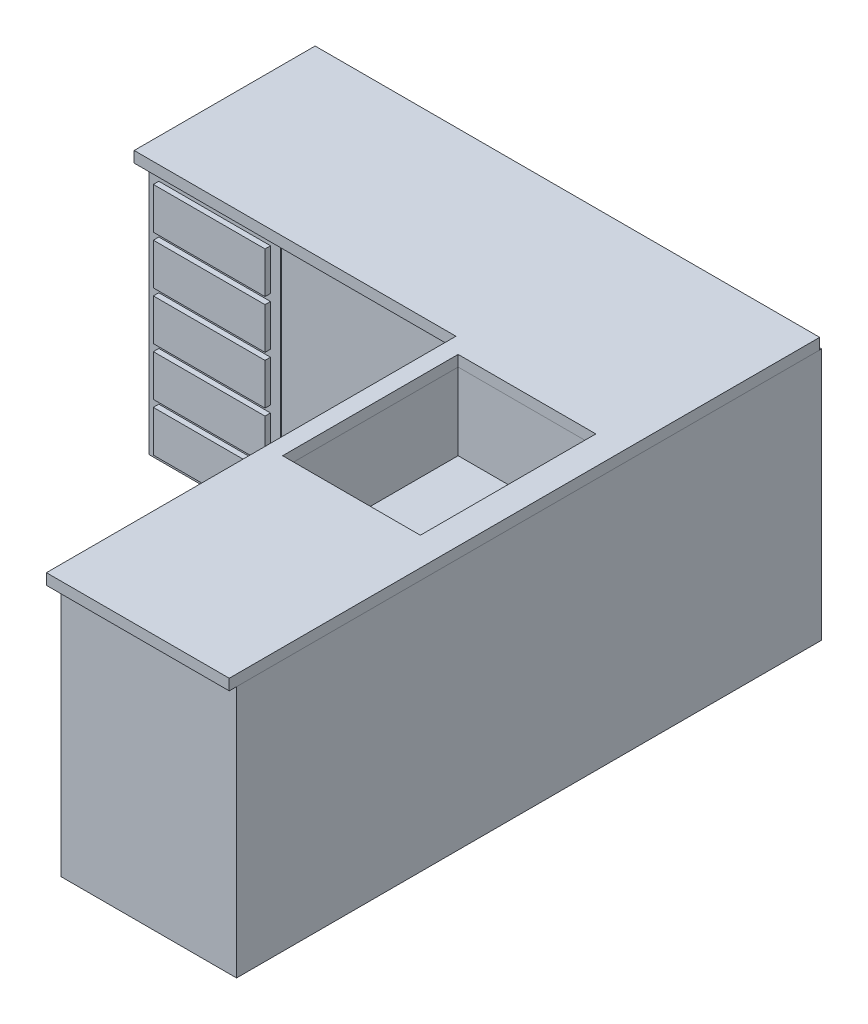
SolidWorks part; units mm, degrees
ref_plane "Front Plane" through (0, 0, 0) normal (0, 0, 1) x (1, 0, 0)
ref_plane "Top Plane" through (0, 0, 0) normal (0, 1, 0) x (1, 0, 0)
ref_plane "Right Plane" through (0, 0, 0) normal (1, 0, 0) x (0, 0, -1)
sketch "Sketch1" plane through (0, 0, 0) normal (0, 0, 1) x (1, 0, 0)
  line L1 (0, 0) -> (1727.2, 0)
  line L2 (0, 0) -> (0, 876.3)
  line L3 (0, 876.3) -> (1727.2, 876.3)
  line L4 (1727.2, 0) -> (1727.2, 876.3)
  dimension "D1" = 876.3
  dimension "D2" = 1727.2
extrude "Boss-Extrude1" add sketch "Sketch1" against normal blind 609.6
sketch "Sketch2" plane through (0, 876.3, 0) normal (0, 1, 0) x (1, 0, 0)
  line L0 (1727.2, 609.6) -> (1727.2, 0) construction
  line L1 (-25.4, 603.0881) -> (1727.2, 603.0881)
  line L2 (-25.4, 603.0881) -> (-25.4, -25.4)
  line L3 (-25.4, -25.4) -> (1727.2, -25.4)
  line L4 (1727.2, 603.0881) -> (1727.2, -25.4)
  line L5 (0, 609.6) -> (0, 0) construction
  line L6 (1727.2, 0) -> (0, 0) construction
  dimension "D1" = 25.4
  dimension "D2" = 25.4
extrude "Boss-Extrude2" add sketch "Sketch2" along normal blind 38.1 separate body
sketch "Sketch3" plane through (0, 0, 0) normal (0, 0, 1) x (1, 0, 0)
  line L0 (1727.2, 876.3) -> (0, 876.3) construction
  line L1 (1117.6, 876.3) -> (1727.2, 876.3)
  line L2 (1117.6, 876.3) -> (1117.6, 0)
  line L3 (1117.6, 0) -> (1727.2, 0)
  line L4 (1727.2, 876.3) -> (1727.2, 0)
  dimension "D1" = 609.6
extrude "Boss-Extrude3" add sketch "Sketch3" along normal blind 1422.4
sketch "Sketch4" plane through (0, 0, 25.4) normal (0, 0, 1) x (1, 0, 0)
  line L0 (-25.4, 876.3) -> (1727.2, 876.3) construction
  line L1 (1727.2, 914.4) -> (1092.2, 914.4)
  line L2 (1727.2, 914.4) -> (1727.2, 876.3)
  line L3 (1727.2, 876.3) -> (1092.2, 876.3)
  line L4 (1092.2, 914.4) -> (1092.2, 876.3)
  dimension "D1" = 25.4
extrude "Boss-Extrude4" add sketch "Sketch4" along normal offset from surface (1422.4 mm away) 25.4
sketch "Sketch6" plane through (0, 0, 0) normal (0, 0, 1) x (1, 0, 0)
  line L0 (1117.6, 876.3) -> (0, 876.3) construction
  line L1 (1066.8, 876.3) -> (457.2, 876.3)
  line L2 (1066.8, 876.3) -> (1066.8, 0)
  line L3 (1066.8, 0) -> (457.2, 0)
  line L4 (457.2, 876.3) -> (457.2, 0)
  line L5 (0, 0) -> (1117.6, 0) construction
  line L6 (0, 876.3) -> (0, 0) construction
  dimension "D1" = 609.6
  dimension "D2" = 457.2
extrude "Cut-Extrude3" cut sketch "Sketch6" against normal through all
sketch "Sketch7" plane through (0, 0, 0) normal (0, 0, 1) x (1, 0, 0)
  line L0 (0, 0) -> (457.2, 0) construction
  line L1 (460.375, 876.3) -> (1057.275, 876.3)
  line L2 (460.375, 876.3) -> (460.375, 0)
  line L3 (460.375, 0) -> (1057.275, 0)
  line L4 (1057.275, 876.3) -> (1057.275, 0)
  line L5 (-25.4, 876.3) -> (1092.2, 876.3) construction
  line L6 (457.2, 876.3) -> (457.2, 0) construction
  dimension "D1" = 596.9
  dimension "D2" = 3.175
extrude "Boss-Extrude5" add sketch "Sketch7" against normal blind 508 separate body
sketch "Sketch8" plane through (0, 0, 0) normal (0, 0, 1) x (1, 0, 0)
  line L1 (34.7836, 839.1775) -> (422.7259, 839.1775)
  line L2 (34.7836, 839.1775) -> (34.7836, 695.5571)
  line L3 (34.7836, 695.5571) -> (422.7259, 695.5571)
  line L4 (422.7259, 839.1775) -> (422.7259, 695.5571)
extrude "Boss-Extrude6" add sketch "Sketch8" along normal blind 19.05
pattern_linear "LPattern1" count 5 spacing 167.64 along (0, -1, 0) of "Boss-Extrude6"
sketch "Sketch9" plane through (1117.6, 0, 0) normal (-1, 0, 0) x (0, 0, 1)
  line L0 (762, 741.0904) -> (762, -73.4332)
  line L1 (762, 741.0904) -> (762, 1094.5811)
  line L2 (0, 876.3) -> (0, 0) construction
  dimension "D1" = 762
sketch "Sketch5" plane through (0, 914.4, 0) normal (0, 1, 0) x (1, 0, 0)
  line L1 (1150.581, -76.2) -> (1628.9482, -76.2)
  line L2 (1150.581, -76.2) -> (1150.581, -685.8)
  line L3 (1150.581, -685.8) -> (1628.9482, -685.8)
  line L4 (1628.9482, -76.2) -> (1628.9482, -685.8)
  point P6 (1150.581, -381)
  dimension "D1" = 609.6
extrude "Cut-Extrude1" cut sketch "Sketch5" against normal blind 304.8
sketch "Sketch10" plane through (1117.6, 0, 0) normal (-1, 0, 0) x (0, 0, 1)
  line L1 (781.1406, 833.7848) -> (1388.4762, 833.7848)
  line L2 (781.1406, 833.7848) -> (781.1406, 579.4172)
  line L3 (781.1406, 579.4172) -> (1388.4762, 579.4172)
  line L4 (1388.4762, 833.7848) -> (1388.4762, 579.4172)
extrude "Boss-Extrude7" add sketch "Sketch10" along normal blind 19.05
pattern_linear "LPattern2" count 3 spacing 266.7 along (0, -1, 0) of "Boss-Extrude7"
sketch "Sketch11" plane through (1117.6, 0, 0) normal (-1, 0, 0) x (0, 0, 1)
  line L0 (762, 876.3) -> (0, 876.3) construction
  line L1 (18.8378, 847.2862) -> (743.1622, 847.2862)
  line L2 (18.8378, 847.2862) -> (18.8378, 692.3783)
  line L3 (18.8378, 692.3783) -> (743.1622, 692.3783)
  line L4 (743.1622, 847.2862) -> (743.1622, 692.3783)
  line L5 (18.8378, 671.3124) -> (372.2304, 671.3124)
  line L6 (18.8378, 671.3124) -> (18.8378, 22.6268)
  line L7 (18.8378, 22.6268) -> (372.2304, 22.6268)
  line L8 (372.2304, 671.3124) -> (372.2304, 22.6268)
  line L9 (389.7696, 671.3124) -> (743.1622, 671.3124)
  line L10 (389.7696, 671.3124) -> (389.7696, 22.6268)
  line L11 (389.7696, 22.6268) -> (743.1622, 22.6268)
  line L12 (743.1622, 671.3124) -> (743.1622, 22.6268)
  line L13 (381, 876.3) -> (381, 1014.602) construction
extrude "Boss-Extrude8" add sketch "Sketch11" along normal blind 19.05
